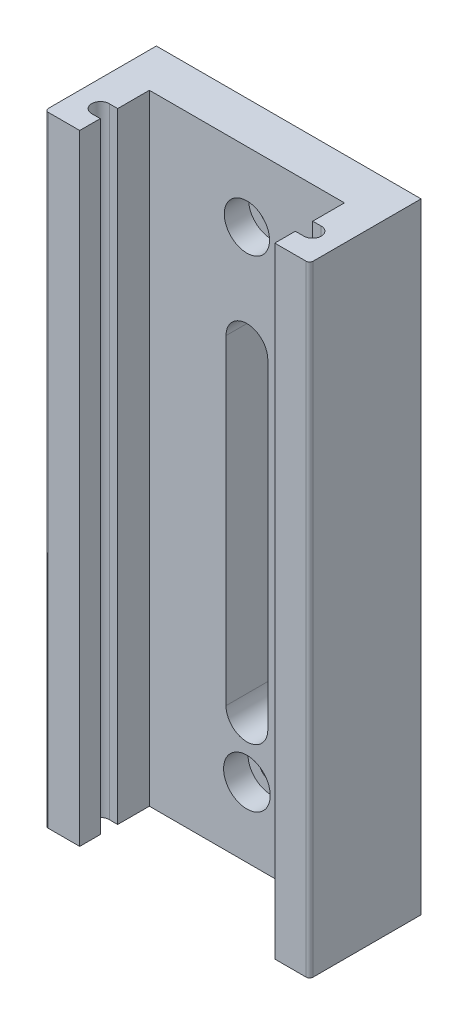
SolidWorks part; units mm, degrees
ref_plane "Plan de face" through (0, 0, 0) normal (0, 0, 1) x (1, 0, 0)
ref_plane "Plan de dessus" through (0, 0, 0) normal (0, 1, 0) x (1, 0, 0)
ref_plane "Plan de droite" through (0, 0, 0) normal (1, 0, 0) x (0, 0, -1)
sketch "Esquisse1" plane through (0, 0, 0) normal (0, 1, 0) x (1, 0, 0)
  line L0 (35.2, 4.2) -> (29.7536, 4.2) construction
  line L1 (19, 16) -> (19, 7.2279) construction
  line L2 (0, 0) -> (0, 16)
  line L3 (0, 16) -> (38, 16)
  line L4 (38, 0) -> (38, 16)
  line L5 (5, 10) -> (33, 10)
  line L6 (33, 10) -> (33, 5.4497)
  line L7 (34.2, 5.4497) -> (33, 5.4497)
  line L8 (34.2, 2.9503) -> (33, 2.9503)
  line L9 (5, 2.9503) -> (5, 0)
  line L10 (33, 2.9503) -> (33, 0)
  line L11 (33, 0) -> (38, 0)
  line L12 (5, 0) -> (0, 0)
  line L13 (3.8, 2.9503) -> (5, 2.9503)
  line L14 (3.8, 5.4497) -> (5, 5.4497)
  line L15 (5, 10) -> (5, 5.4497)
  arc A0 (3.8, 5.4497) -> (3.8, 2.9503) centre (3.7726, 4.2) ccw
  arc A2 (34.2, 5.4497) -> (34.2, 2.9503) centre (34.2274, 4.2) cw
  point P15 (2.8, 2.3279)
  point P16 (2.8, 6.0721)
  point P29 (35.2, 6.0721)
  point P32 (35.2, 2.3279)
  dimension "D5" = 1.25
  dimension "D1" = 38
  dimension "D2" = 16
  dimension "D3" = 6
  dimension "D4" = 4.2
extrude "Extrusion1" add sketch "Esquisse1" along normal blind 89
sketch "Esquisse2" plane through (0, 0, -10) normal (0, 0, 1) x (1, 0, 0)
  line L0 (19, 89) -> (19, 0) construction
  line L1 (5, 89) -> (33, 89) construction
  line L2 (5, 0) -> (33, 0) construction
  circle A0 centre (19, 79) radius 3.25
  circle A1 centre (19, 10) radius 3.35
  dimension "D1" = 6.5
  dimension "D3" = 10
  dimension "D2" = 10
extrude "Enlèv. mat.-Extru.1" cut sketch "Esquisse2" against normal blind 3.5
sketch "Esquisse3" plane through (0, 0, -13.5) normal (0, 0, 1) x (1, 0, 0)
  circle A0 centre (19, 79) radius 1.75
  circle A1 centre (19, 10) radius 1.75
extrude "Enlèv. mat.-Extru.2" cut sketch "Esquisse3" against normal through all
sketch "Esquisse4" plane through (0, 0, -10) normal (0, 0, 1) x (1, 0, 0)
  line L0 (19, 89) -> (19, 0) construction
  line L1 (22, 64) -> (22, 18)
  line L2 (16, 64) -> (16, 18)
  line L5 (5, 89) -> (33, 89) construction
  line L6 (5, 0) -> (33, 0) construction
  arc A0 (22, 64) -> (16, 64) centre (19, 64) ccw
  arc A1 (16, 18) -> (22, 18) centre (19, 18) ccw
  dimension "D6" = 3
  dimension "D1" = 18
  dimension "D2" = 25
extrude "Enlèv. mat.-Extru.3" cut sketch "Esquisse4" against normal through all
ref_plane "Plan1" through (19, 0, 0) normal (1, 0, 0) x (0, 0, -1)
fillet "Congé1" radius 0.5 2 edges at (0, 44.5, 0) (38, 44.5, 0)
